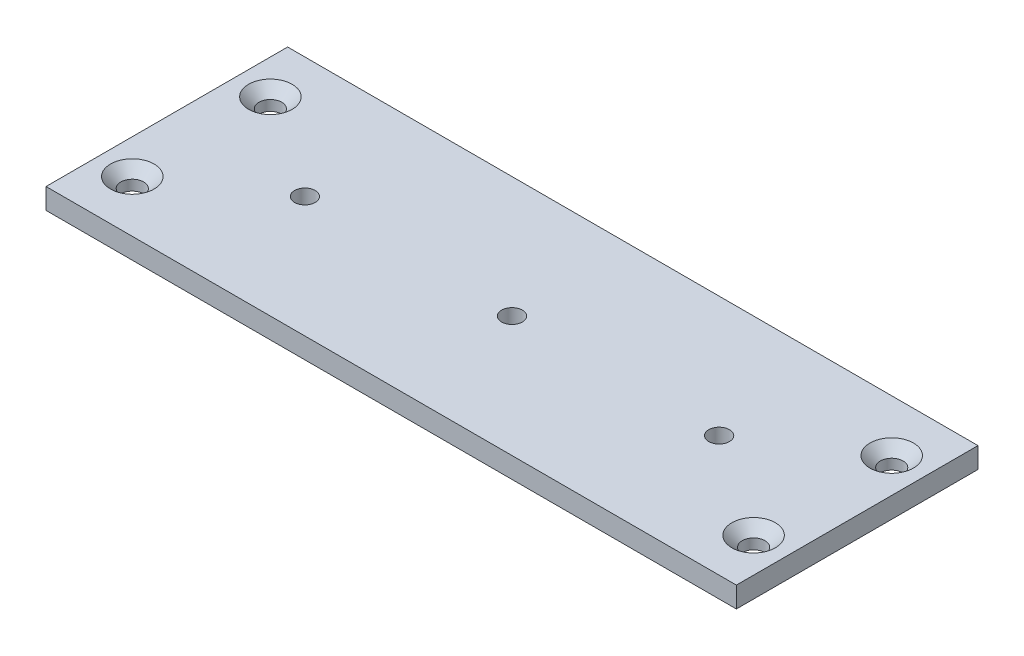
SolidWorks part; units mm, degrees
ref_plane "Front Plane" through (0, 0, 0) normal (0, 0, 1) x (1, 0, 0)
ref_plane "Top Plane" through (0, 0, 0) normal (0, 1, 0) x (1, 0, 0)
ref_plane "Right Plane" through (0, 0, 0) normal (1, 0, 0) x (0, 0, -1)
sketch "Sketch1" plane through (0, 0, 0) normal (0, 1, 0) x (1, 0, 0)
  line L1 (0, 0) -> (200, 0)
  line L2 (0, 0) -> (0, 70)
  line L3 (0, 70) -> (200, 70)
  line L4 (200, 0) -> (200, 70)
  dimension "D1" = 70
  dimension "D2" = 200
extrude "Extrude1" add sketch "Sketch1" along normal blind 6
sketch "Sketch2" plane through (0, 6, 0) normal (0, 1, 0) x (1, 0, 0)
  line L0 (0, 35) -> (200, 35) construction
  line L1 (0, 70) -> (0, 0) construction
  line L2 (200, 0) -> (200, 70) construction
  line L3 (100, 70) -> (100, 0) construction
  line L4 (200, 70) -> (0, 70) construction
  line L5 (0, 0) -> (200, 0) construction
  line L6 (10, 70) -> (10, 0) construction
  line L7 (190, 70) -> (190, 0) construction
  circle A0 centre (100, 35) radius 3
  circle A1 centre (40, 35) radius 3
  circle A2 centre (160, 35) radius 3
  point P25 (190, 55)
  point P26 (190, 15)
  point P27 (10, 55)
  point P28 (10, 15)
  dimension "D1" = 60
  dimension "D2" = 60
  dimension "D3" = 6
  dimension "D4" = 10
  dimension "D5" = 10
  dimension "D6" = 15
  dimension "D7" = 15
  dimension "D8" = 15
  dimension "D9" = 15
extrude "Extrude2" cut sketch "Sketch2" against normal through all
hole_wizard "CSK for M6 Countersunk Flat Head Screw1" positions "3DSketch2" profile "Sketch5" countersink size "M6" standard "ISO"
sketch3d "3DSketch2"
  point P0 (10, 6, -55)
  point P3 (10, 6, -15)
  point P6 (190, 6, -55)
  point P9 (190, 6, -15)
sketch "Sketch5" plane through (10, 6, -55) normal (1, 0, 0) x (0, 0, 1)
  line L0 (0, 0) -> (0, 6)
  line L1 (0, 6) -> (3.3, 6)
  line L2 (3.3, 6) -> (3.3, 3)
  line L3 (3.3, 3) -> (6.3, 0)
  line L5 (6.3, 0) -> (0, 0)
  line L6 (-3.3, 3) -> (-6.3, 0) construction
  line L11 (0, -6.35) -> (0, 107.95) construction
  dimension "Thru Hole Dia." = 6.6
  dimension "Thru Hole Depth" = 6
  dimension "Near C'Sink Dia." = 12.6
  dimension "Near C'Sink Angle" = 90
